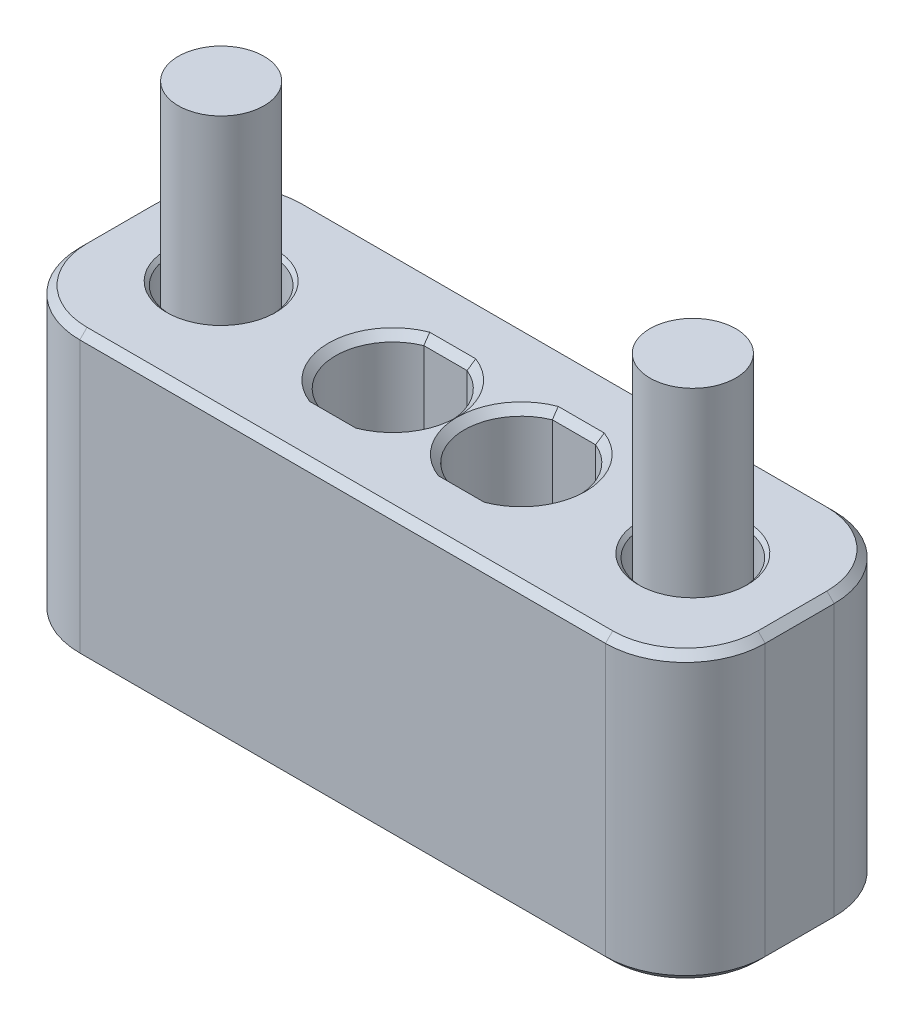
SolidWorks part; units mm, degrees
other "<SHCSM6L25>-<HEX>"
ref_plane "Front Plane" through (0, 0, 0) normal (0, 0, 1) x (1, 0, 0)
ref_plane "Top Plane" through (0, 0, 0) normal (0, 1, 0) x (1, 0, 0)
ref_plane "Right Plane" through (0, 0, 0) normal (1, 0, 0) x (0, 0, -1)
sketch "Sketch1" plane through (0, 0, 0) normal (0, 1, 0) x (1, 0, 0)
  line L1 (-23.9776, -8.001) -> (23.9776, -8.001)
  line L2 (-23.9776, -8.001) -> (-23.9776, 8.001)
  line L3 (-23.9776, 8.001) -> (23.9776, 8.001)
  line L4 (23.9776, -8.001) -> (23.9776, 8.001)
  line L5 (-23.9776, -8.001) -> (23.9776, 8.001) construction
  line L6 (-23.9776, 8.001) -> (23.9776, -8.001) construction
  point P0 (0, 0)
  dimension "D1" = 47.9552
  dimension "D2" = 16.002
extrude "Extrude1" add sketch "Sketch1" along normal blind 19.9898
fillet "Fillet1" radius 5.588 4 edges at (-23.9776, 9.9949, -8.001) (-23.9776, 9.9949, 8.001) (23.9776, 9.9949, -8.001) (23.9776, 9.9949, 8.001)
sketch "Sketch4" plane through (0, 19.9898, 0) normal (0, 1, 0) x (1, 0, 0)
  line L0 (-6.0095, 3.6893) -> (-2.9821, 3.6893)
  line L1 (-0.2714, 0) -> (-16.7902, 0) construction
  line L2 (-6.0095, -3.6894) -> (-2.9821, -3.6894)
  line L3 (0, 0) -> (0, 10.6435) construction
  line L4 (6.0095, -3.6894) -> (2.9821, -3.6893)
  line L5 (6.0095, 3.6894) -> (2.9821, 3.6893)
  arc A0 (-2.9821, -3.6894) -> (-2.9821, 3.6893) centre (-4.4958, 0) ccw
  arc A1 (-6.0095, 3.6893) -> (-6.0095, -3.6894) centre (-4.4958, 0) ccw
  arc A2 (6.0095, 3.6894) -> (6.0095, -3.6894) centre (4.4958, 0) cw
  arc A3 (2.9821, -3.6893) -> (2.9821, 3.6893) centre (4.4958, 0) cw
  dimension "D2" = 7.9756
  dimension "D3" = 4.4958
  dimension "D1" = 7.3787
extrude "Extrude2" cut sketch "Sketch4" against normal through all
chamfer "Chamfer2" distance 0.508 angle 45 16 edges at (-0.508, 19.9898, 0) (-4.4958, 19.9898, 3.6894) (-8.4836, 19.9898, 0) (-4.4958, 19.9898, -3.6893) (-4.4958, 0, 3.6894) (-0.508, 0, 0) (-8.4836, 0, 0) (-4.4958, 0, -3.6893) (0.508, 0, 0) (4.4958, 0, 3.6894) (8.4836, 0, 0) (4.4958, 0, -3.6894) (8.4836, 19.9898, 0) (4.4958, 19.9898, 3.6894) (0.508, 19.9898, 0) (4.4958, 19.9898, -3.6894)
sketch "Sketch3" plane through (0, 0, 0) normal (0, 0, 1) x (1, 0, 0)
  line L0 (-16.5, -4.1204) -> (-16.5, 20.8145) construction
  line L1 (-16.5, 19.9898) -> (-20.31, 19.9898)
  line L2 (-18.3896, 19.9898) -> (18.3896, 19.9898) construction
  line L3 (-20.056, 7.112) -> (-21.6562, 7.112)
  line L4 (-21.6562, 7.112) -> (-21.6562, 0.508)
  line L5 (-20.056, 19.7358) -> (-20.056, 7.112)
  line L6 (-18.3896, 0) -> (18.3896, 0) construction
  line L7 (-22.1642, 0) -> (-16.5, 0)
  line L8 (-16.5, 0) -> (-16.5, 19.9898)
  line L9 (-20.056, 19.7358) -> (-20.31, 19.9898)
  line L10 (-21.6562, 0.508) -> (-22.1642, 0)
  dimension "D1" = 16.5
  dimension "D2" = 7.112
  dimension "D3" = 10.3124
  dimension "D4" = 0.508
  dimension "D5" = 45
  dimension "D6" = 0.254
  dimension "D7" = 45
  dimension "D8" = 7.112
revolve "Cut-Revolve2" cut sketch "Sketch3" angle 360 about L0
chamfer "Chamfer1" distance 0.508 angle 45 16 edges at (0, 0, -8.001) (-22.3409, 0, -6.3643) (22.3409, 0, -6.3643) (-23.9776, 0, 0) (23.9776, 0, 0) (-22.3409, 0, 6.3643) (22.3409, 0, 6.3643) (0, 0, 8.001) (0, 19.9898, -8.001) (-22.3409, 19.9898, -6.3643) (22.3409, 19.9898, -6.3643) (-23.9776, 19.9898, 0) (23.9776, 19.9898, 0) (-22.3409, 19.9898, 6.3643) (22.3409, 19.9898, 6.3643) (0, 19.9898, 8.001)
mirror "Mirror6" about plane through (0, 0, 0) normal (1, 0, 0) of "Cut-Revolve2"
inserted part "SHCSM6L25"
move or copy body "Body-Move/Copy2" placed by mates yes
mirror "Mirror7" about plane through (0, 0, 0) normal (1, 0, 0)
